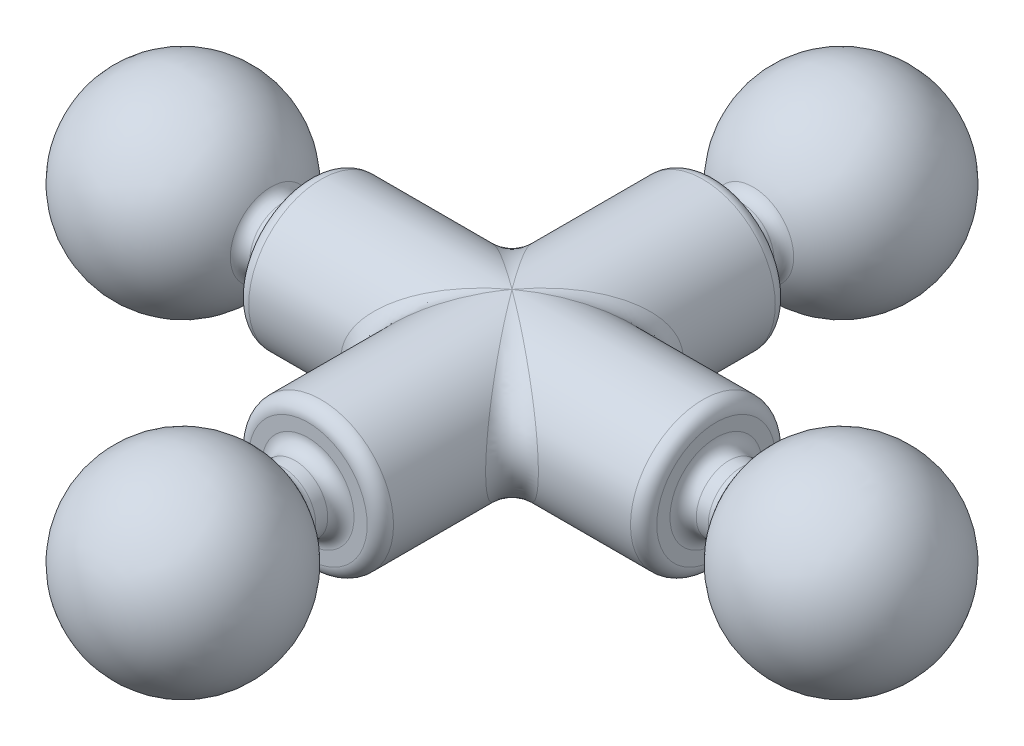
SolidWorks part; units mm, degrees
ref_plane "Front" through (0, 0, 0) normal (0, 0, 1) x (1, 0, 0)
ref_plane "Top" through (0, 0, 0) normal (0, 1, 0) x (1, 0, 0)
ref_plane "Right" through (0, 0, 0) normal (1, 0, 0) x (0, 0, -1)
sketch "Sketch1" plane through (0, 0, 0) normal (0, 0, 1) x (1, 0, 0)
  line L0 (-53.1625, 0) -> (68.201, 0) construction
  line L1 (0, 0) -> (0, -51.4476) construction
  line L2 (-22.1081, 3.175) -> (-20.955, 3.175)
  line L3 (22.1081, 3.175) -> (20.955, 3.175)
  line L4 (-19.685, 4.445) -> (-19.685, 5.715)
  line L5 (19.685, 4.445) -> (19.685, 5.715)
  line L6 (-18.415, 6.985) -> (18.415, 6.985)
  line L7 (-41.0972, 0) -> (41.0972, 0)
  arc A0 (-23.2614, 3.9133) -> (-41.0972, 0) centre (-31.75, 0) ccw
  arc A1 (23.2614, 3.9133) -> (41.0972, 0) centre (31.75, 0) cw
  arc A2 (-22.1081, 3.175) -> (-23.2614, 3.9133) centre (-22.1081, 4.445) cw
  arc A3 (-20.955, 3.175) -> (-19.685, 4.445) centre (-20.955, 4.445) ccw
  arc A4 (-19.685, 5.715) -> (-18.415, 6.985) centre (-18.415, 5.715) cw
  arc A5 (19.685, 5.715) -> (18.415, 6.985) centre (18.415, 5.715) ccw
  arc A6 (20.955, 3.175) -> (19.685, 4.445) centre (20.955, 4.445) cw
  arc A7 (22.1081, 3.175) -> (23.2614, 3.9133) centre (22.1081, 4.445) ccw
  point P16 (0, 6.985)
  point P18 (-22.9586, 3.175)
  point P21 (-19.685, 3.175)
  point P24 (-19.685, 6.985)
  point P27 (19.685, 6.985)
  point P30 (19.685, 3.175)
  point P33 (22.9586, 3.175)
  dimension "D2" = 9.3472
  dimension "D6" = 1.27
  dimension "D1" = 3.175
  dimension "D3" = 6.985
  dimension "D4" = 31.75
  dimension "D5" = 12.065
revolve "Revolve1" add sketch "Sketch1" angle 360 about L0
ref_plane "Plane1" through (-31.75, 0, 0) normal (1, 0, 0) x (0, 0, -1)
sketch "Sketch2" plane through (0, 0, 0) normal (1, 0, 0) x (0, 0, -1)
  line L0 (-53.1625, 0) -> (68.201, 0) construction
  line L1 (0, 0) -> (0, -51.4476) construction
  line L2 (-22.1081, 3.175) -> (-20.955, 3.175)
  line L3 (22.1081, 3.175) -> (20.955, 3.175)
  line L4 (-19.685, 4.445) -> (-19.685, 5.715)
  line L5 (19.685, 4.445) -> (19.685, 5.715)
  line L6 (-18.415, 6.985) -> (18.415, 6.985)
  line L7 (-41.0972, 0) -> (41.0972, 0)
  line L8 (50, 0) -> (-50, 0) construction
  line L9 (0, 50) -> (0, -50) construction
  arc A0 (-23.2614, 3.9133) -> (-41.0972, 0) centre (-31.75, 0) ccw
  arc A1 (23.2614, 3.9133) -> (41.0972, 0) centre (31.75, 0) cw
  arc A2 (-22.1081, 3.175) -> (-23.2614, 3.9133) centre (-22.1081, 4.445) cw
  arc A3 (-20.955, 3.175) -> (-19.685, 4.445) centre (-20.955, 4.445) ccw
  arc A4 (-19.685, 5.715) -> (-18.415, 6.985) centre (-18.415, 5.715) cw
  arc A5 (19.685, 5.715) -> (18.415, 6.985) centre (18.415, 5.715) ccw
  arc A6 (20.955, 3.175) -> (19.685, 4.445) centre (20.955, 4.445) cw
  arc A7 (22.1081, 3.175) -> (23.2614, 3.9133) centre (22.1081, 4.445) ccw
  point P16 (0, 6.985)
  point P18 (-22.9586, 3.175)
  point P21 (-19.685, 3.175)
  point P24 (-19.685, 6.985)
  point P27 (19.685, 6.985)
  point P30 (19.685, 3.175)
  point P33 (22.9586, 3.175)
revolve "Revolve2" add sketch "Sketch2" angle 360 about L0
fillet "Fillet1" radius 2.54 4 edges at (6.985, 0, -6.985) (-6.985, 0, -6.985) (-6.985, 0, 6.985) (6.985, 0, 6.985)
